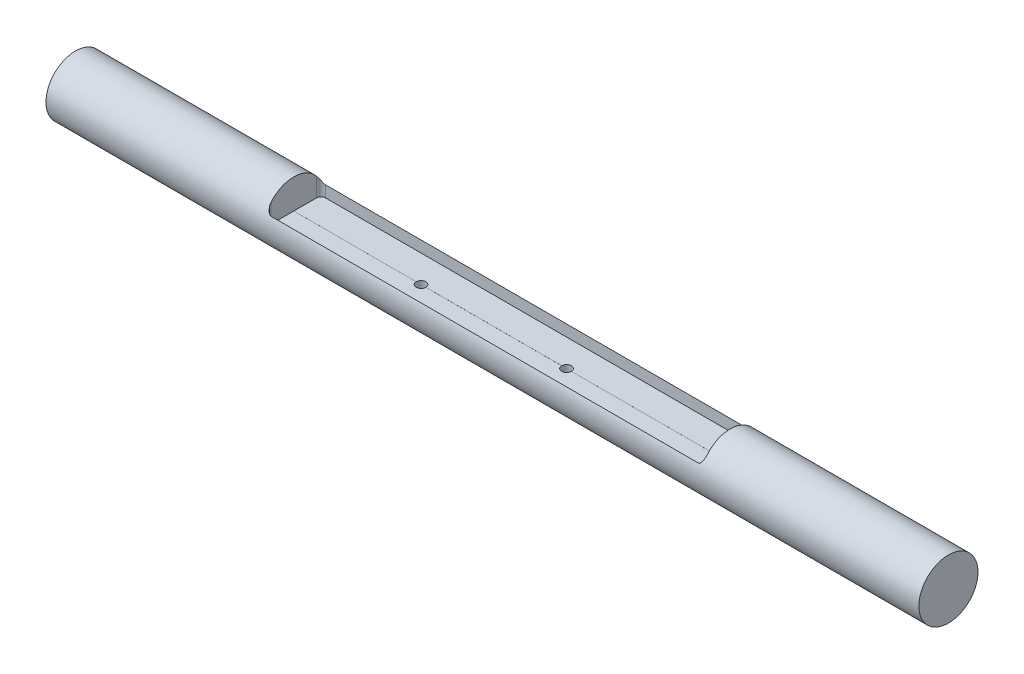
SolidWorks part; units mm, degrees
ref_plane "Front" through (0, 0, 0) normal (0, 0, 1) x (1, 0, 0)
ref_plane "Top" through (0, 0, 0) normal (0, 1, 0) x (1, 0, 0)
ref_plane "Right" through (0, 0, 0) normal (1, 0, 0) x (0, 0, -1)
sketch "Sketch1" plane through (0, 0, 0) normal (1, 0, 0) x (0, 0, -1)
  circle A0 centre (0, 0) radius 20.6375
  circle A1 centre (0, 0) radius 0.0127
  point P4 (20.6375, 0)
  point P5 (0.0127, 0)
  dimension "OD" = 41.275
  dimension "ID" = 0.0254
  dimension "Wall" = 20.6248
extrude "Extrude1" add sketch "Sketch1" along normal mid plane 609.6
sketch "Sketch2" plane through (0, 0, 0) normal (0, 0, 1) x (1, 0, 0)
  line L0 (-304.8, 0) -> (304.8, 0) construction
  line L1 (-304.8, 20.6375) -> (-304.8, -20.6375) construction
sketch "Sketch3" plane through (0, 0, 0) normal (0, 1, 0) x (1, 0, 0)
  line L1 (149.225, 19.05) -> (-149.225, 19.05)
  line L2 (152.4, 15.875) -> (152.4, -15.875)
  line L3 (149.225, -19.05) -> (-149.225, -19.05)
  line L4 (-152.4, 15.875) -> (-152.4, -15.875)
  line L5 (152.4, 19.05) -> (-152.4, -19.05) construction
  line L6 (152.4, -19.05) -> (-152.4, 19.05) construction
  arc A0 (-149.225, 19.05) -> (-152.4, 15.875) centre (-149.225, 15.875) ccw
  arc A1 (-149.225, -19.05) -> (-152.4, -15.875) centre (-149.225, -15.875) cw
  arc A2 (152.4, -15.875) -> (149.225, -19.05) centre (149.225, -15.875) cw
  arc A3 (149.225, 19.05) -> (152.4, 15.875) centre (149.225, 15.875) cw
  point P0 (0, 0)
  dimension "D1" = 3.175
  dimension "D2" = 304.8
  dimension "D3" = 38.1
extrude "Pocket" cut sketch "Sketch3" along normal through all
sketch "Sketch4" plane through (0, 0, 0) normal (0, 1, 0) x (1, 0, 0)
  line L0 (38.1, 0) -> (-63.5, 0) construction
  circle A0 centre (38.1, 0) radius 3.3782
  circle A1 centre (-63.5, 0) radius 3.3782
  point P4 (0, 0)
  dimension "D1" = 6.7564
  dimension "D3" = 63.5
  dimension "D2" = 101.6
extrude "Screw holes" cut sketch "Sketch4" against normal through all
sketch "Sketch5" plane through (0, 0, 0) normal (0, 1, 0) x (1, 0, 0)
  circle A0 centre (177.8, 0) radius 1.5875
  dimension "D1" = 3.175
  dimension "D2" = 177.8
extrude "Vent hole" [suppressed] cut sketch "Sketch5" along normal through all
pattern_linear "LPattern1" [suppressed] count 16 spacing 6.35
pattern_circular "CirPattern1" [suppressed] count 16 over 360
mirror "Mirror1" [suppressed] about plane through (0, 0, 0) normal (1, 0, 0)
